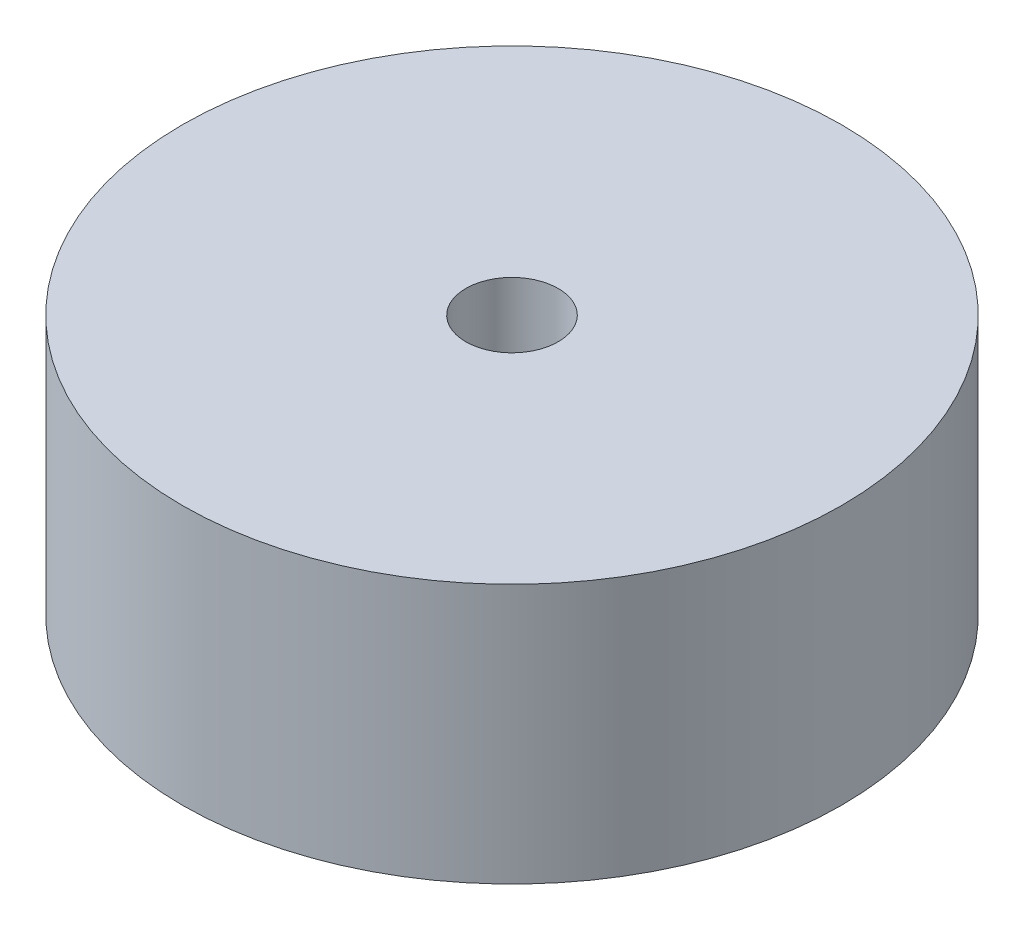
SolidWorks part; units mm, degrees
ref_plane "Front Plane" through (0, 0, 0) normal (0, 0, 1) x (1, 0, 0)
ref_plane "Top Plane" through (0, 0, 0) normal (0, 1, 0) x (1, 0, 0)
ref_plane "Right Plane" through (0, 0, 0) normal (1, 0, 0) x (0, 0, -1)
sketch "Sketch1" plane through (0, 0, 0) normal (0, 1, 0) x (1, 0, 0)
  circle A0 centre (-10.5434, 3.571) radius 6.35
  dimension "D1" = 12.7
extrude "Boss-Extrude1" add sketch "Sketch1" along normal blind 5
sketch "Sketch2" plane through (0, 5, 0) normal (0, 1, 0) x (1, 0, 0)
  line L0 (-16.8934, 3.571) -> (-4.1934, 3.571) construction
  circle A0 centre (-10.5434, 3.571) radius 6.35 construction
  circle A1 centre (-10.5434, 3.571) radius 0.89
  dimension "D1" = 1.78
extrude "Cut-Extrude1" cut sketch "Sketch2" against normal blind 8
